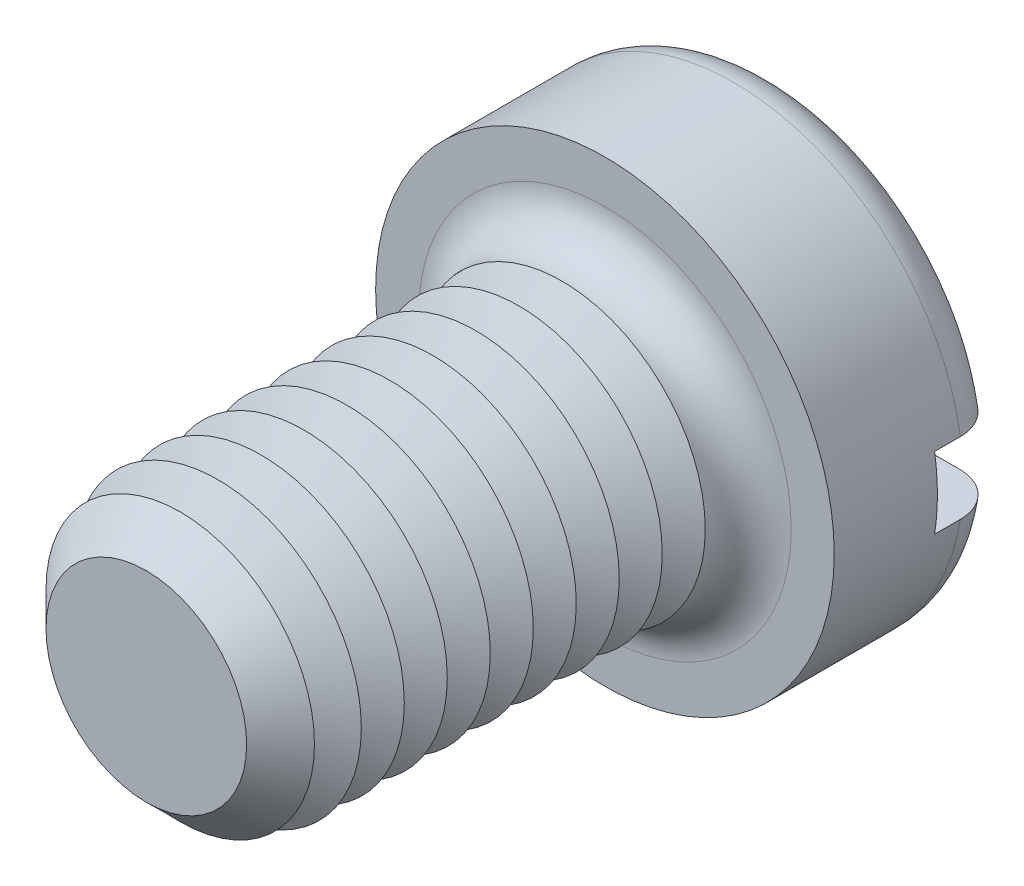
SolidWorks part; units mm, degrees
ref_plane "Front Plane" through (0, 0, 0) normal (0, 0, 1) x (1, 0, 0)
ref_plane "Top Plane" through (0, 0, 0) normal (0, 1, 0) x (1, 0, 0)
ref_plane "Right Plane" through (0, 0, 0) normal (1, 0, 0) x (0, 0, -1)
sketch "Sketch3" plane through (0, 0, 0) normal (0, 0, 1) x (1, 0, 0)
  circle A0 centre (0, 0) radius 8
  dimension "D1" = 16
extrude "Boss-Extrude2" add sketch "Sketch3" against normal blind 6
sketch "Sketch4" plane through (0, 0, 0) normal (0, 0, 1) x (1, 0, 0)
  circle A0 centre (0, 0) radius 5
  dimension "D1" = 10
extrude "Boss-Extrude3" add sketch "Sketch4" along normal blind 16
fillet "Fillet1" radius 1.5 2 edges at (8, 0, -6) (5, 0, 0)
chamfer "Chamfer1" distance 1.5 angle 45 1 edges at (5, 0, 16)
sketch "Sketch5" plane through (0, 0, 0) normal (1, 0, 0) x (0, 0, -1)
  line L0 (1.6944, 0) -> (-7.6738, 0) construction
sketch "Sketch6" plane through (0, 0, 0) normal (1, 0, 0) x (0, 0, -1)
  line L0 (-1.5, 5) -> (-2.25, 3.701)
  line L1 (-2.25, 3.701) -> (-3, 5)
  line L2 (-1.5, 5) -> (-14.5, 5) construction
  line L3 (-3, 5) -> (-1.5, 5)
  dimension "D1" = 1.5
revolve "Cut-Revolve1" cut sketch "Sketch6" angle 360 about L0
pattern_linear "LPattern1" count 9 spacing 1.5 along (0, 0, 1) of "Cut-Revolve1"
sketch "Sketch8" plane through (0, 0, -6) normal (0, 0, -1) x (-1, 0, 0)
  line L1 (8, -1.25) -> (-8, -1.25)
  line L2 (8, -1.25) -> (8, 1.25)
  line L3 (8, 1.25) -> (-8, 1.25)
  line L4 (-8, -1.25) -> (-8, 1.25)
  line L5 (8, -1.25) -> (-8, 1.25) construction
  line L6 (8, 1.25) -> (-8, -1.25) construction
  point P0 (0, 0)
  dimension "D1" = 16
  dimension "D2" = 2.5
extrude "Cut-Extrude1" cut sketch "Sketch8" against normal blind 2.4
